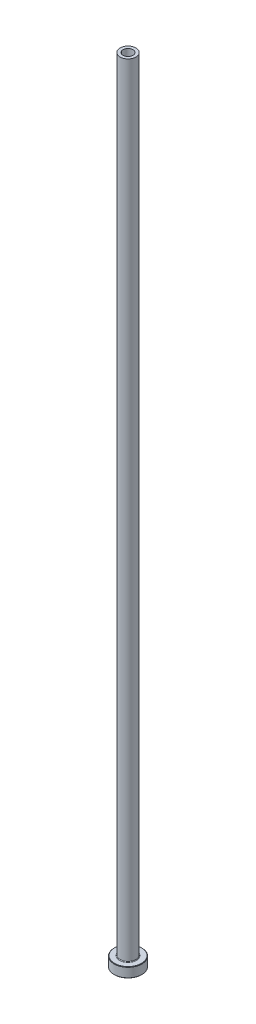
SolidWorks part; units mm, degrees
ref_plane "Front Plane" through (0, 0, 0) normal (0, 0, 1) x (1, 0, 0)
ref_plane "Top Plane" through (0, 0, 0) normal (0, 1, 0) x (1, 0, 0)
ref_plane "Right Plane" through (0, 0, 0) normal (1, 0, 0) x (0, 0, -1)
sketch "Sketch1" plane through (0, 0, 0) normal (0, 0, 1) x (1, 0, 0)
  line L0 (-2.5, 400) -> (-4, 400)
  line L1 (-4, 400) -> (-4, 5)
  line L2 (-4, 5) -> (-7, 5)
  line L3 (-7, 5) -> (-7, 0)
  line L4 (7.7, 0) -> (-7.7, 0) construction
  line L5 (-7, 0) -> (-2.75, 0)
  line L6 (-2.5, 355) -> (-2.5, 400)
  line L7 (0, 92.1877) -> (0, -15.5353) construction
  line L8 (0, -7.7) -> (0, 7.7) construction
  line L9 (-2.5, 355) -> (-2.75, 343)
  line L10 (-2.75, 343) -> (-2.75, 0)
  dimension "D1" = 0.25
  dimension "ID" = 5
  dimension "OD" = 8
  dimension "L" = 400
  dimension "H" = 14
  dimension "T" = 5
  dimension "N" = 45
  dimension "D2" = 12
revolve "Revolve1" add sketch "Sketch1" angle 360 about L7
fillet "Fillet1" radius 0.3 1 edges at (0, 5, 4)
chamfer "Chamfer1" distance 0.2 angle 45 2 edges at (0, 5, 7) (0, 0, 7)
chamfer "Chamfer3" distance 0.5 angle 45 1 edges at (0, 0, 2.75)
